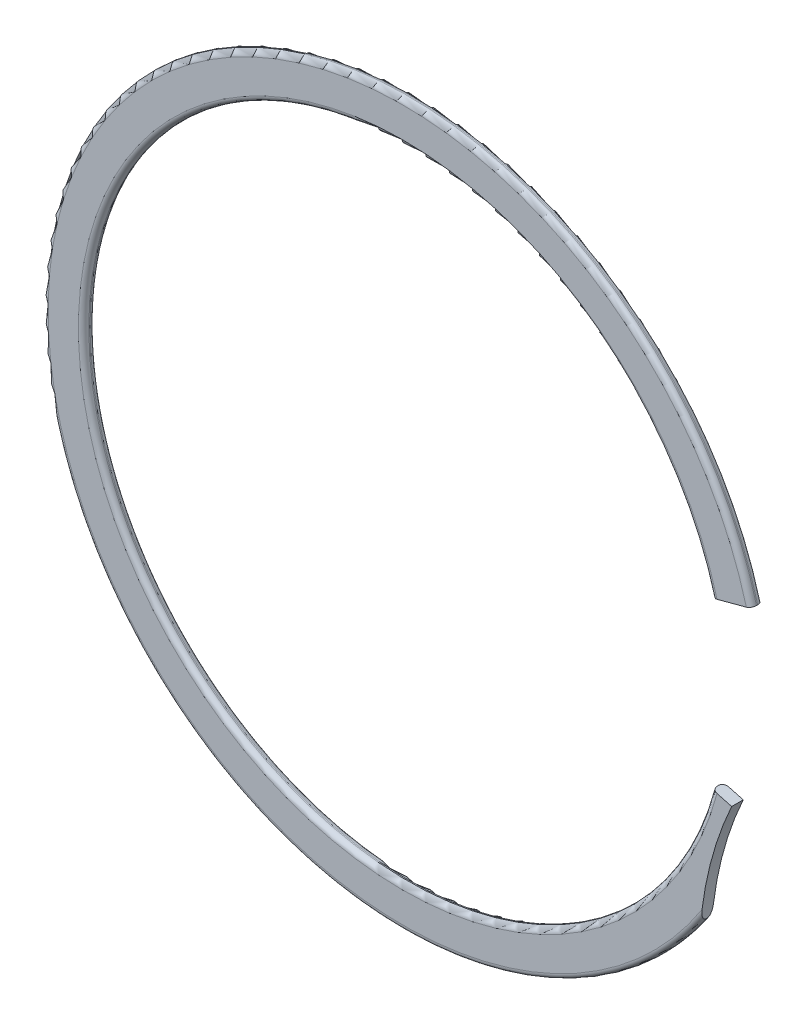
SolidWorks part; units mm, degrees
ref_plane "Front Plane" through (0, 0, 0) normal (0, 0, 1) x (1, 0, 0)
ref_plane "Top Plane" through (0, 0, 0) normal (0, 1, 0) x (1, 0, 0)
ref_plane "Right Plane" through (0, 0, 0) normal (1, 0, 0) x (0, 0, -1)
sketch "Sketch1" plane through (0, 0, 0) normal (0, 0, 1) x (1, 0, 0)
  line L0 (17.5641, 0) -> (19.7993, 0) construction
  line L1 (-17.5641, 0) -> (-19.7993, 0) construction
  line L2 (16.9656, 4.5459) -> (19.1247, 5.1244)
  line L3 (16.9656, -4.5459) -> (19.1247, -5.1244)
  line L4 (18.0451, -4.8352) -> (16.3478, -11.1696) construction
  line L5 (16.3478, -11.1696) -> (14.0414, -10.5516) construction
  line L6 (16.3478, -11.1696) -> (14.5023, -9.9087) construction
  line L7 (15.425, -10.5392) -> (18.0451, -4.8352) construction
  circle A0 centre (0, 0) radius 17.5641
  circle A1 centre (0, 0) radius 19.7993
  arc A3 (18.0451, -4.8352) -> (16.3478, -11.1696) centre (35.7814, -12.9822) ccw
  dimension "Free Diameter" = 39.5986
  dimension "Radial Wall" = 2.2352
  dimension "D3" = 30
sketch "Sketch2" plane through (0, 0, 0) normal (0, 0, 1) x (1, 0, 0)
  line L0 (16.9656, -4.5459) -> (19.1247, -5.1244) construction
  line L1 (16.9656, 4.5459) -> (19.1247, 5.1244) construction
  line L2 (16.9656, -4.5459) -> (18.0451, -4.8352)
  line L3 (16.9656, 4.5459) -> (19.1247, 5.1244)
  circle A0 centre (0, 0) radius 19.7993 construction
  circle A2 centre (0, 0) radius 17.5641 construction
  arc A3 (19.1247, 5.1244) -> (16.3478, -11.1696) centre (0, 0) ccw
  arc A4 (18.0451, -4.8352) -> (16.3478, -11.1696) centre (35.7814, -12.9822) ccw construction
  arc A5 (16.9656, 4.5459) -> (16.9656, -4.5459) centre (0, 0) ccw
  arc A6 (16.9656, 4.5459) -> (16.9656, -4.5459) centre (0, 0) cw construction
  arc A7 (19.1247, 5.1244) -> (19.1247, -5.1244) centre (0, 0) cw construction
  arc A8 (18.0451, -4.8352) -> (16.3478, -11.1696) centre (35.7814, -12.9822) ccw
extrude "Extrude1" add sketch "Sketch2" along normal mid plane 0.635
fillet "Fillet1" radius 0.2858 4 edges at (-19.5179, 3.3262, -0.3175) (-19.5179, 3.3262, 0.3175) (-17.5641, 0, -0.3175) (-17.5641, 0, 0.3175)
sketch "Sketch3" plane through (0, 0, 0) normal (1, 0, 0) x (0, 0, -1)
  line L0 (-0.3937, 19.05) -> (-0.3937, 19.6088)
  line L1 (-0.3937, 19.6088) -> (0.3937, 19.6088)
  line L2 (0.3937, 19.6088) -> (0.3937, 19.05)
  line L3 (0.3937, 19.05) -> (41.6719, 19.05)
  line L5 (-0.3937, 19.05) -> (-5.9531, 19.05)
  line L6 (41.6719, 19.05) -> (41.6719, 20.1676)
  line L7 (-5.9531, 20.1676) -> (-5.9531, 19.05)
  line L8 (-0.3937, 19.6088) -> (-0.3937, 20.1676) construction
  line L9 (-5.9531, 0) -> (41.6719, 0) construction
  line L10 (0, 0) -> (0, 19.6088) construction
  line L11 (41.6719, 20.1676) -> (-5.9531, 20.1676)
  dimension "D1" = 47.625
  dimension "Groove width" = 0.7874
  dimension "groove dia" = 39.2176
  dimension "shaft dia" = 38.1
  dimension "D4" = 5.9531
revolve "Revolve1" [suppressed] add sketch "Sketch3" angle 360 about L9
equation "\"D1@Fillet1\" = (\"Ring Thickness@Extrude1\"*.9)/2"
equation "\"D1@Sketch3\" = \"shaft dia@Sketch3\"*1.25"
equation "\"D4@Sketch3\" = \"D1@Sketch3\"/8"
